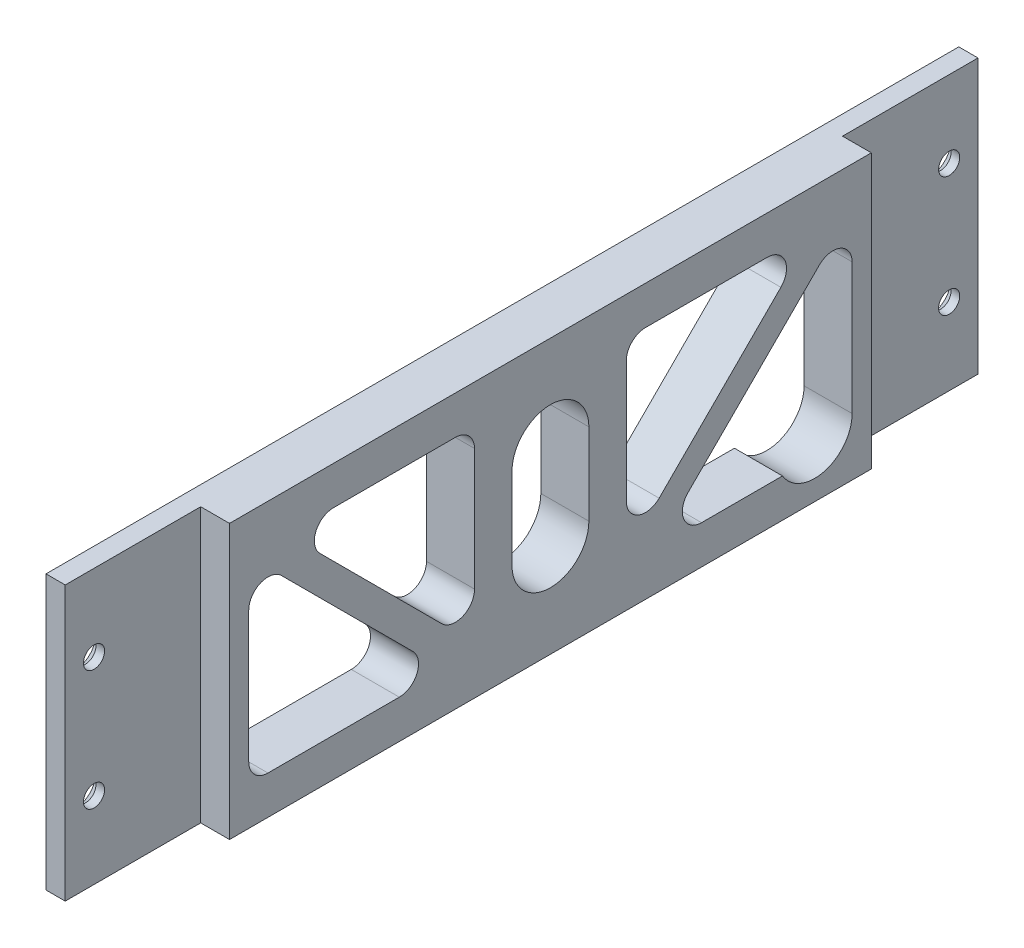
SolidWorks part; units mm, degrees
ref_plane "Front Plane" through (0, 0, 0) normal (0, 0, 1) x (1, 0, 0)
ref_plane "Top Plane" through (0, 0, 0) normal (0, 1, 0) x (1, 0, 0)
ref_plane "Right Plane" through (0, 0, 0) normal (1, 0, 0) x (0, 0, -1)
sketch "Sketch1" plane through (0, 0, 0) normal (1, 0, 0) x (0, 0, -1)
  line L1 (47.5, 14.25) -> (-47.5, 14.25)
  line L2 (47.5, 14.25) -> (47.5, -14.25)
  line L3 (47.5, -14.25) -> (-47.5, -14.25)
  line L4 (-47.5, 14.25) -> (-47.5, -14.25)
  line L5 (47.5, 14.25) -> (-47.5, -14.25) construction
  line L6 (47.5, -14.25) -> (-47.5, 14.25) construction
  point P0 (0, 0)
  dimension "D1" = 95
  dimension "D2" = 28.5
extrude "Boss-Extrude1" add sketch "Sketch1" along normal blind 2
sketch "Sketch2" plane through (2, 0, 0) normal (1, 0, 0) x (0, 0, -1)
  line L0 (47.5, 14.25) -> (-47.5, 14.25) construction
  line L1 (-33.4, 14.25) -> (33.4, 14.25)
  line L2 (-33.4, 14.25) -> (-33.4, -14.25)
  line L3 (-33.4, -14.25) -> (33.4, -14.25)
  line L4 (33.4, 14.25) -> (33.4, -14.25)
  line L5 (-47.5, -14.25) -> (47.5, -14.25) construction
  line L6 (-47.5, 14.25) -> (-47.5, -14.25) construction
  line L7 (47.5, -14.25) -> (47.5, 14.25) construction
  dimension "D1" = 14.1
  dimension "D2" = 14.1
extrude "Boss-Extrude2" add sketch "Sketch2" along normal blind 3
hole_wizard "CSK for M2 Countersunk Flat Head Screw1" positions "Sketch7" profile "Sketch6" countersink size "M2" standard "ISO"
sketch "Sketch7" plane through (0, 0, 0) normal (-1, 0, 0) x (0, 0, 1)
  line L0 (-47.5, 14.25) -> (47.5, 14.25) construction
  line L1 (47.5, -14.25) -> (-47.5, -14.25) construction
  line L2 (47.5, -14.25) -> (-47.5, -14.25) construction
  line L3 (-47.5, -14.25) -> (-47.5, 14.25) construction
  line L4 (47.5, 14.25) -> (47.5, -14.25) construction
  point P0 (44.5, 6.25)
  point P2 (44.5, -6.25)
  point P4 (-44.5, 6.25)
  point P6 (-44.5, -6.25)
  dimension "D1" = 8
  dimension "D2" = 8
  dimension "D3" = 8
  dimension "D4" = 8
  dimension "D5" = 3
  dimension "D6" = 3
  dimension "D7" = 3
  dimension "D8" = 3
sketch "Sketch6" plane through (0, 6.25, 44.5) normal (0, 1, 0) x (0, 0, 1)
  line L0 (0, 0) -> (0, 5)
  line L1 (0, 5) -> (1.1, 5)
  line L2 (1.1, 5) -> (1.1, 1.1)
  line L3 (1.1, 1.1) -> (2.2, 0)
  line L5 (2.2, 0) -> (0, 0)
  line L6 (-1.1, 1.1) -> (-2.2, 0) construction
  line L11 (0, -6.35) -> (0, 107.95) construction
  dimension "Thru Hole Dia." = 2.2
  dimension "Thru Hole Depth" = 5
  dimension "Near C'Sink Dia." = 4.4
  dimension "Near C'Sink Angle" = 90
sketch "Sketch9" plane through (0, 0, 0) normal (-1, 0, 0) x (0, 0, 1)
  line L1 (-31.4, 5.4216) -> (-31.4, -8.25)
  line L2 (-29.4, -10.25) -> (-15.7284, -10.25)
  line L3 (-14.3142, -6.8358) -> (-27.9858, 6.8358)
  line L4 (-22.5716, 10.25) -> (-9.9, 10.25)
  line L5 (-7.9, 8.25) -> (-7.9, -4.4216)
  line L6 (-11.3142, -5.8358) -> (-23.9858, 6.8358)
  line L7 (-33.4, -14.25) -> (-33.4, 14.25) construction
  line L8 (47.5, -14.25) -> (-47.5, -14.25) construction
  line L9 (-47.5, 14.25) -> (47.5, 14.25) construction
  arc A0 (-22.5716, 10.25) -> (-23.9858, 6.8358) centre (-22.5716, 8.25) ccw
  arc A1 (-9.9, 10.25) -> (-7.9, 8.25) centre (-9.9, 8.25) cw
  arc A2 (-7.9, -4.4216) -> (-11.3142, -5.8358) centre (-9.9, -4.4216) cw
  arc A3 (-31.4, -8.25) -> (-29.4, -10.25) centre (-29.4, -8.25) ccw
  arc A4 (-15.7284, -10.25) -> (-14.3142, -6.8358) centre (-15.7284, -8.25) ccw
  arc A5 (-31.4, 5.4216) -> (-27.9858, 6.8358) centre (-29.4, 5.4216) cw
  point P14 (-27.4, 10.25)
  point P25 (-31.4, 10.25)
  dimension "D8" = 2
  dimension "D1" = 2
  dimension "D2" = 4
  dimension "D3" = 4
  dimension "D4" = 45
  dimension "D5" = 23.5
  dimension "D6" = 45
  dimension "D7" = 4
extrude "Cut-Extrude1" cut sketch "Sketch9" against normal through all
mirror "Mirror1" about plane through (0, 0, 0) normal (0, 0, 1) of "Cut-Extrude1"
sketch "Sketch10" plane through (0, 0, 0) normal (-1, 0, 0) x (0, 0, 1)
  line L0 (0, 4.25) -> (0, -4.25) construction
  line L1 (4, 4.25) -> (4, -4.25)
  line L2 (-4, 4.25) -> (-4, -4.25)
  line L3 (-47.5, 14.25) -> (47.5, 14.25) construction
  line L4 (47.5, -14.25) -> (-47.5, -14.25) construction
  arc A0 (4, 4.25) -> (-4, 4.25) centre (0, 4.25) ccw
  arc A1 (-4, -4.25) -> (4, -4.25) centre (0, -4.25) ccw
  point P3 (0, 0)
  dimension "D3" = 4
  dimension "D1" = 10
  dimension "D2" = 10
extrude "Cut-Extrude2" cut sketch "Sketch10" against normal blind 10
sketch "Sketch13" plane through (0, 0, 0) normal (-1, 0, 0) x (0, 0, 1)
  line L0 (-47.5, -14.25) -> (-47.5, 14.25) construction
  line L1 (47.5, -14.25) -> (-47.5, -14.25) construction
  circle A0 centre (-27.5, -8.25) radius 3.9
  dimension "D3" = 7.8
  dimension "D1" = 20
  dimension "D2" = 6
extrude "Cut-Extrude3" cut sketch "Sketch13" against normal blind 10
